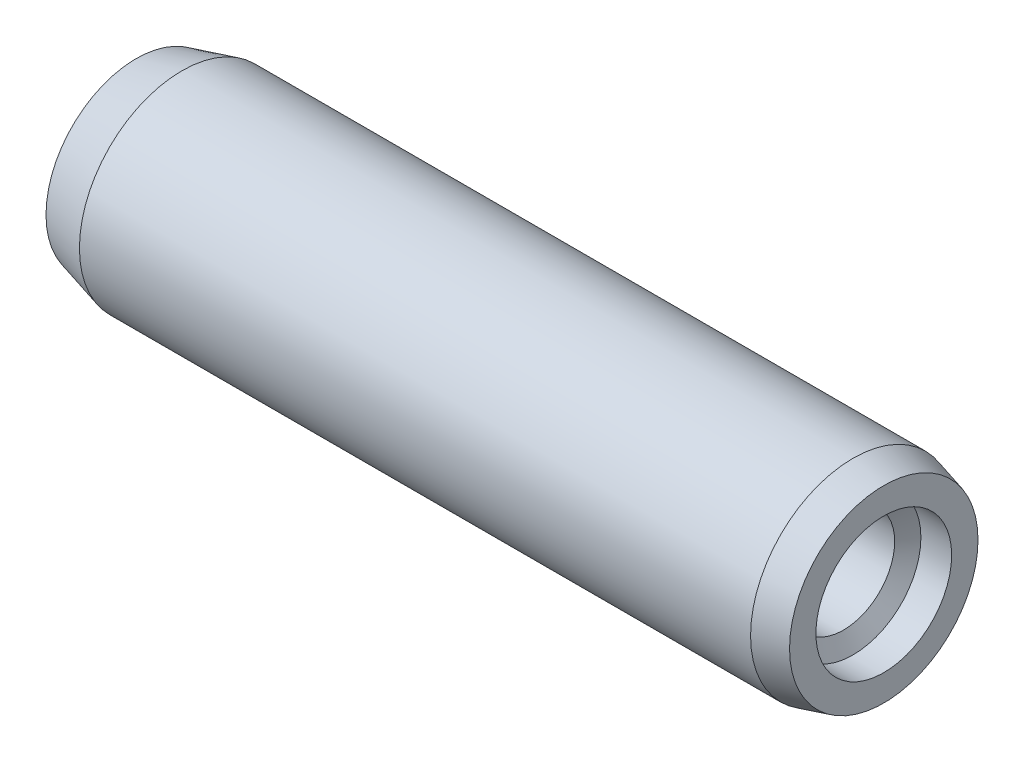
SolidWorks part; units mm, degrees
ref_plane "Plan1" through (0, 0, 0) normal (0, 0, 1) x (1, 0, 0)
ref_plane "Plan2" through (0, 0, 0) normal (0, 1, 0) x (1, 0, 0)
ref_plane "Plan3" through (0, 0, 0) normal (1, 0, 0) x (0, 0, -1)
sketch "Esquisse1" plane through (0, 0, 0) normal (0, 0, 1) x (1, 0, 0)
  line L0 (-7.0625, 0) -> (36.9107, 0) construction
  line L1 (0.8171, 3.5223) -> (2.6, 4)
  line L2 (2.6, 4) -> (28.8, 4)
  line L3 (28.8, 4) -> (30, 3.6785)
  line L4 (30, 3.6785) -> (30, 0)
  line L5 (30, 0) -> (0, 0)
  arc A0 (0.8171, 3.5223) -> (0, 0) centre (8, 0) ccw
  dimension "D1" = 8
  dimension "D2" = 30
  dimension "D3" = 15
  dimension "D4" = 1.2
  dimension "D5" = 2.6
  dimension "D6" = 15
  dimension "D7" = 4
revolve "Base-Révolution" add sketch "Esquisse1" angle 360 about L0
hole_wizard "Perçage1" positions "Esquisse4" profile "Esquisse3"
sketch "Esquisse4" plane through (30, 0, 0) normal (1, 0, 0) x (0, 0, -1)
  point P0 (0, 0)
sketch "Esquisse3" plane through (30, 0, 0) normal (0, 1, 0) x (0, 0, -1)
  line L0 (0, 0) -> (0, 13.1547)
  line L1 (0, 13.1547) -> (2, 12)
  line L2 (2, 12) -> (2, 0)
  line L4 (2, 0) -> (0, 0)
  line L6 (0, 13.1547) -> (-2, 12) construction
  line L7 (0, -4.2442) -> (0, 117.3081) construction
  dimension "Diamètre" = 4
  dimension "Profondeur" = 12
  dimension "Angle" = 120
hole_wizard "Perçage2" positions "Esquisse6" profile "Esquisse5"
sketch "Esquisse6" plane through (30, 0, 0) normal (1, 0, 0) x (0, 0, -1)
  point P0 (0, 0)
sketch "Esquisse5" plane through (30, 0, 0) normal (0, 1, 0) x (0, 0, -1)
  line L0 (0, 0) -> (0, 2.73)
  line L1 (0, 2.73) -> (2.65, 1.2)
  line L2 (2.65, 1.2) -> (2.65, 0)
  line L4 (2.65, 0) -> (0, 0)
  line L6 (0, 2.73) -> (-2.65, 1.2) construction
  line L7 (0, -4.2442) -> (0, 117.3081) construction
  dimension "Diamètre" = 5.3
  dimension "Profondeur" = 1.2
  dimension "Angle" = 120
